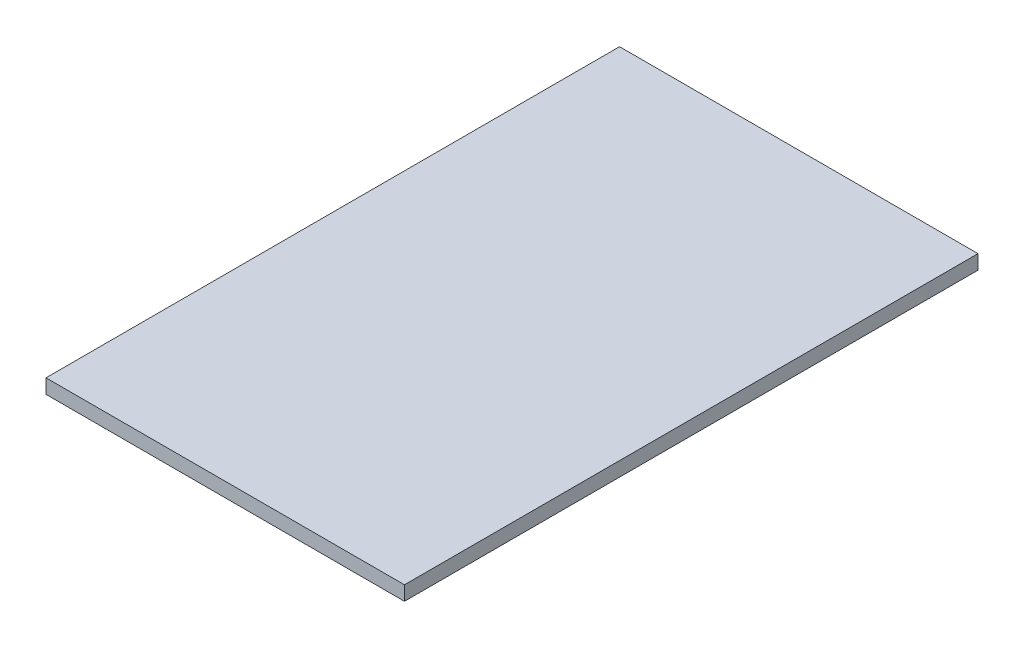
SolidWorks part; units mm, degrees
ref_plane "Front Plane" through (0, 0, 0) normal (0, 0, 1) x (1, 0, 0)
ref_plane "Top Plane" through (0, 0, 0) normal (0, 1, 0) x (1, 0, 0)
ref_plane "Right Plane" through (0, 0, 0) normal (1, 0, 0) x (0, 0, -1)
sketch "Sketch2" plane through (0, 0, 0) normal (0, 1, 0) x (1, 0, 0)
  line L1 (0, 0) -> (63.5, 0)
  line L2 (0, 0) -> (0, 101.6)
  line L3 (0, 101.6) -> (63.5, 101.6)
  line L4 (63.5, 0) -> (63.5, 101.6)
  dimension "D1" = 101.6
  dimension "D2" = 63.5
extrude "Boss-Extrude1" add sketch "Sketch2" along normal blind 2.54
